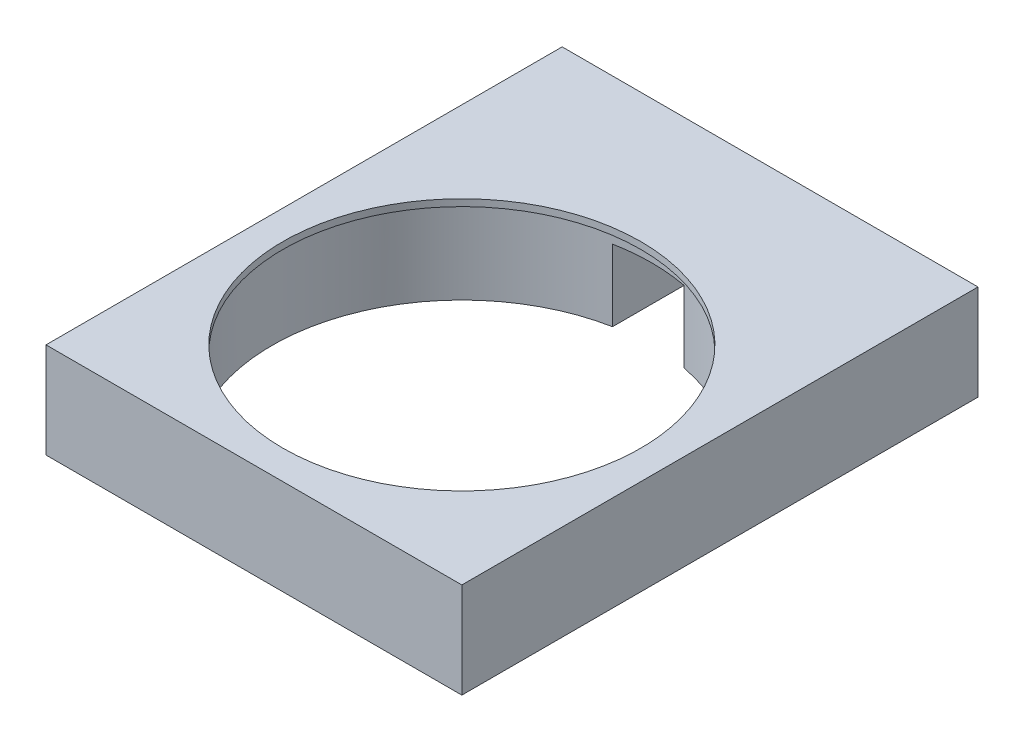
SolidWorks part; units mm, degrees
ref_plane "Front Plane" through (0, 0, 0) normal (0, 0, 1) x (1, 0, 0)
ref_plane "Top Plane" through (0, 0, 0) normal (0, 1, 0) x (1, 0, 0)
ref_plane "Right Plane" through (0, 0, 0) normal (1, 0, 0) x (0, 0, -1)
body saved out of another part "Stock-charging stand-1"
sketch "Sketch2" plane through (0, 94.75, 0) normal (0, 1, 0) x (1, 0, 0)
  circle A0 centre (0, -61) radius 13.125
  dimension "D1" = 26.25
extrude "Cut-Extrude1" cut sketch "Sketch2" against normal up to next
sketch "Sketch3" plane through (0, 87.5, 0) normal (0, -1, 0) x (1, 0, 0)
  line L0 (2.625, 38.1442) -> (2.625, 47.3247) construction
  line L1 (2.625, 53.1442) -> (-2.625, 53.1442)
  line L2 (2.625, 53.1442) -> (2.625, 38.1442)
  line L3 (2.625, 38.1442) -> (-2.625, 38.1442)
  line L4 (-2.625, 53.1442) -> (-2.625, 38.1442)
  dimension "D1" = 15
extrude "Cut-Extrude2" cut sketch "Sketch3" against normal blind 5.5
sketch "Sketch4" plane through (0, 94.75, 0) normal (0, 1, 0) x (1, 0, 0)
  line L0 (15.5, -38.1442) -> (-15.5, -38.1442) construction
  line L1 (-15.25, -38.3942) -> (15.25, -38.3942)
  line L2 (-15.25, -38.3942) -> (-15.25, -76.25)
  line L3 (-15.25, -76.25) -> (15.25, -76.25)
  line L4 (15.25, -38.3942) -> (15.25, -76.25)
  line L5 (-15.5, -38.1442) -> (-15.5, -76.5) construction
  line L6 (-15.5, -76.5) -> (15.5, -76.5) construction
  line L7 (15.5, -38.1442) -> (15.5, -76.5) construction
  dimension "D1" = 0.25
  dimension "D2" = 0.25
  dimension "D3" = 0.25
  dimension "D4" = 0.25
extrude "Cut-Extrude3" cut sketch "Sketch4" against normal through all flip side to cut
sketch "Sketch10" plane through (0, 87.5, 0) normal (0, -1, 0) x (1, 0, 0)
  line L1 (15.25, 76.25) -> (-15.25, 76.25)
  line L2 (15.25, 76.25) -> (15.25, 38.3942)
  line L3 (15.25, 38.3942) -> (-15.25, 38.3942)
  line L4 (-15.25, 76.25) -> (-15.25, 38.3942)
extrude "Cut-Extrude4" cut sketch "Sketch10" against normal blind 0.25 contours L2 L3 L4 L1
ref_plane "mirror plane" through (0, 0, 57.3221) normal (0, 0, 1) x (1, 0, 0)
sketch "Sketch7" plane through (0, 87.75, 0) normal (0, -1, 0) x (1, 0, 0)
  line L0 (-2.625, 38.3942) -> (-15.25, 38.3942) construction
  circle A0 centre (-15.25, 76.25) radius 6
  circle A1 centre (15.25, 76.25) radius 6
  circle A2 centre (15.25, 38.3942) radius 6
  circle A3 centre (-15.25, 38.3942) radius 6
  dimension "D1" = 12
extrude "Boss-Extrude3" [suppressed] add sketch "Sketch7" against normal blind 0.35 contours A0
sketch "Sketch8" [suppressed] plane through (0, 88.1, 0) normal (0, 1, 0) x (1, 0, 0)
  line L0 (-14.75, -32.8942) -> (-14.75, -38.8942) construction
  line L1 (-14.75, -38.8942) -> (-20.75, -38.8942) construction
  line L2 (-14.75, -38.8942) -> (-18.9926, -34.6516) construction
  line L4 (-15.25, -38.3942) -> (-15.25, -44.3942) construction
  line L5 (-9.25, -38.3942) -> (-15.25, -38.3942) construction
  line L6 (-14.25, -32.8942) -> (-14.25, -38.8942)
  line L7 (-15.1036, -39.2478) -> (-19.3462, -35.0052)
  line L8 (-14.75, -39.3942) -> (-20.75, -39.3942)
  line L9 (-15.25, -32.8942) -> (-15.25, -38.8942)
  line L10 (-14.3964, -38.5407) -> (-18.6391, -34.298)
  line L11 (-14.75, -38.3942) -> (-20.75, -38.3942)
  line L12 (-14.25, -32.8942) -> (-15.25, -32.8942)
  line L13 (-14.25, -38.8942) -> (-15.25, -38.8942)
  line L14 (-15.1036, -39.2478) -> (-14.3964, -38.5407)
  line L15 (-19.3462, -35.0052) -> (-18.6391, -34.298)
  line L16 (-14.75, -39.3942) -> (-14.75, -38.3942)
  line L17 (-20.75, -39.3942) -> (-20.75, -38.3942)
  dimension "D1" = 0.5
  dimension "D2" = 0.5
  dimension "D3" = 45
  dimension "D4" = 6
  dimension "D5" = 0.5
  dimension "D6" = 0.5
extrude "Boss-Extrude4" [suppressed] add sketch "Sketch8" along normal blind 2 contours L8 L17 L11 L16 | L7 L15 L10 L14 | L9 L13 L6 L12
chamfer "Chamfer2" [suppressed] distance 1.5 angle 45
mirror "Mirror3" [suppressed] about plane through (0, 0, 0) normal (1, 0, 0)
mirror "Mirror4" [suppressed] about plane through (0, 0, 57.3221) normal (0, 0, 1)
sketch "Sketch9" plane through (0, 87.75, 0) normal (0, -1, 0) x (1, 0, 0)
  line L1 (-2.625, 38.3942) -> (2.625, 38.3942)
  line L2 (-2.625, 38.3942) -> (-2.625, 47.3247)
  line L3 (-2.625, 47.3247) -> (2.625, 47.3247)
  line L4 (2.625, 38.3942) -> (2.625, 47.3247)
extrude "Boss-Extrude5" [suppressed] add sketch "Sketch9" against normal blind 0.35
